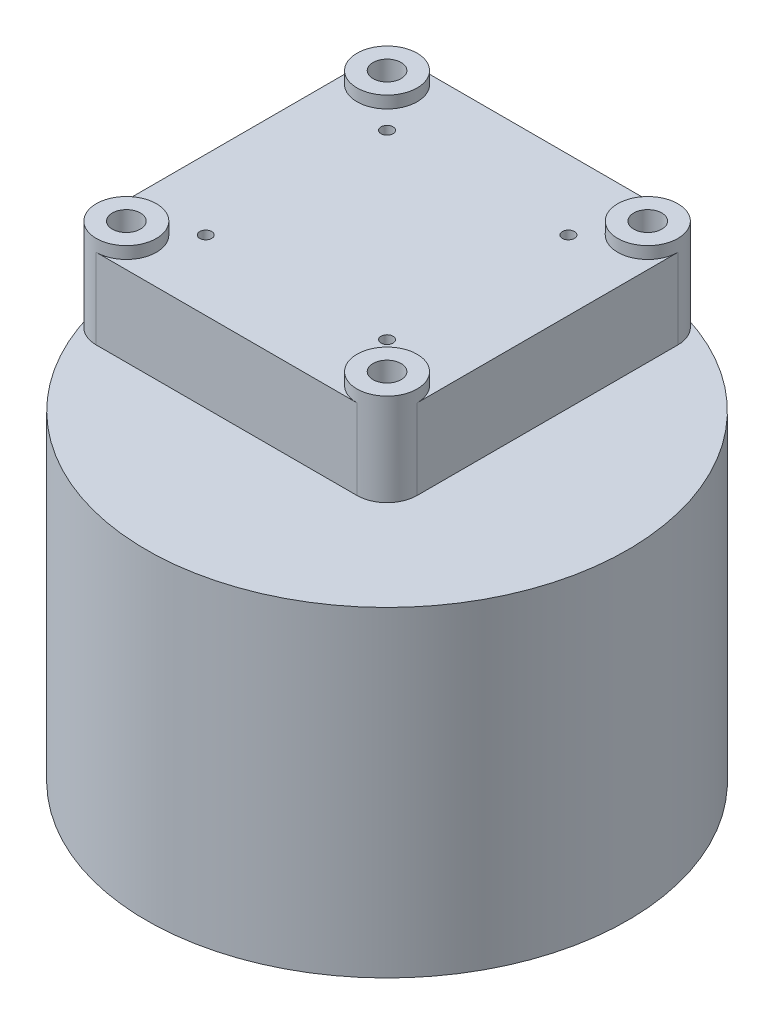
SolidWorks part; units mm, degrees
ref_plane "Front Plane" through (0, 0, 0) normal (0, 0, 1) x (1, 0, 0)
ref_plane "Top Plane" through (0, 0, 0) normal (0, 1, 0) x (1, 0, 0)
ref_plane "Right Plane" through (0, 0, 0) normal (1, 0, 0) x (0, 0, -1)
sketch "Sketch1" plane through (0, 0, 0) normal (0, 1, 0) x (1, 0, 0)
  line L0 (51.9659, 0) -> (-55.8196, 0) construction
  line L1 (-32.5, -40) -> (32.5, -40)
  line L2 (-40, -32.5) -> (-40, 32.5)
  line L3 (-32.5, 40) -> (32.5, 40)
  line L4 (40, -32.5) -> (40, 32.5)
  line L5 (-40, -40) -> (40, 40) construction
  line L6 (-40, 40) -> (40, -40) construction
  line L7 (0, -48.933) -> (0, 55.862) construction
  circle A0 centre (32.5, 32.5) radius 3.5
  circle A1 centre (-32.5, -32.5) radius 3.5
  circle A2 centre (-32.5, 32.5) radius 3.5
  circle A3 centre (32.5, -32.5) radius 3.5
  arc A5 (-32.5, -40) -> (-40, -32.5) centre (-32.5, -32.5) cw
  arc A6 (32.5, -40) -> (40, -32.5) centre (32.5, -32.5) ccw
  arc A7 (32.5, 40) -> (40, 32.5) centre (32.5, 32.5) cw
  arc A8 (-40, 32.5) -> (-32.5, 40) centre (-32.5, 32.5) cw
  circle A9 centre (22.6005, -22.6005) radius 1.5
  circle A10 centre (-22.6005, -22.6005) radius 1.5
  circle A11 centre (-22.6005, 22.6005) radius 1.5
  circle A12 centre (22.6005, 22.6005) radius 1.5
  point P0 (0, 0)
  dimension "D3" = 7
  dimension "D5" = 7.5
  dimension "D6" = 3
  dimension "D7" = 14
  dimension "D1" = 80
  dimension "D2" = 80
  dimension "D4" = 7.5
extrude "Boss-Extrude1" add sketch "Sketch1" along normal blind 20
sketch "Sketch2" plane through (0, 0, 0) normal (0, -1, 0) x (1, 0, 0)
  circle A0 centre (0, 0) radius 17.5
extrude "Boss-Extrude2" add sketch "Sketch2" along normal blind 18
sketch "Sketch3" plane through (0, -18, 0) normal (0, -1, 0) x (1, 0, 0)
  circle A0 centre (0, 0) radius 60
  dimension "D1" = 120
extrude "Boss-Extrude3" add sketch "Sketch3" along normal blind 80
sketch "Sketch4" plane through (0, 20, 0) normal (0, 1, 0) x (1, 0, 0)
  line L0 (37.9809, 0) -> (-39.1715, 0) construction
  line L1 (0, 43.4251) -> (0, -51.6078) construction
  circle A0 centre (32.5, 32.5) radius 7.5
  circle A1 centre (32.5, -32.5) radius 7.5
  circle A4 centre (32.5, 32.5) radius 3.5
  circle A5 centre (32.5, -32.5) radius 3.5
  circle A8 centre (-32.5, -32.5) radius 3.5
  circle A9 centre (-32.5, -32.5) radius 7.5
  circle A10 centre (-32.5, 32.5) radius 3.5
  circle A11 centre (-32.5, 32.5) radius 7.5
extrude "Boss-Extrude5" add sketch "Sketch4" along normal blind 3
